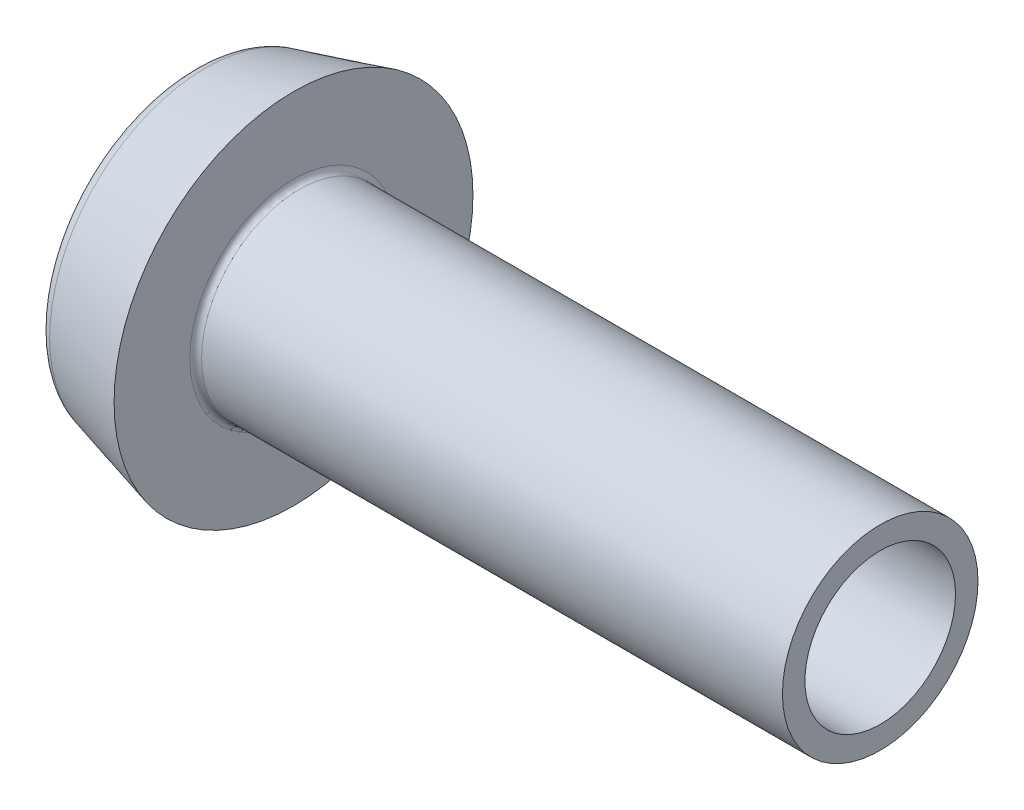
SolidWorks part; units mm, degrees
ref_plane "Front" through (0, 0, 0) normal (0, 0, 1) x (1, 0, 0)
ref_plane "Top" through (0, 0, 0) normal (0, 1, 0) x (1, 0, 0)
ref_plane "Right" through (0, 0, 0) normal (1, 0, 0) x (0, 0, -1)
other "Configuration Table"
sketch "Sketch1" plane through (0, 0, 0) normal (0, 0, 1) x (1, 0, 0)
  line L0 (-47.217, 0) -> (5.8534, 0) construction
  line L1 (35.24, 0) -> (35.24, 5)
  line L2 (35.24, 5) -> (5.54, 5)
  line L3 (5.24, 5.3) -> (5.24, 9.175)
  line L4 (5.24, 9.175) -> (0.7412, 7.9695)
  line L5 (0, 7.0036) -> (0, 0)
  line L6 (35.24, 0) -> (0, 0)
  arc A0 (5.54, 5) -> (5.24, 5.3) centre (5.54, 5.3) cw
  arc A1 (0.7412, 7.9695) -> (0, 7.0036) centre (1, 7.0036) ccw
  point P11 (5.24, 5)
  dimension "r" = 0.3
  dimension "r1" = 1
  dimension "D1" = 15
  dimension "d" = 10
  dimension "dk" = 18.35
  dimension "K" = 5.24
  dimension "l" = 30
revolve "Base-Revolve" add sketch "Sketch1" angle 360 about L0
sketch "Sketch2" plane through (0, 0, 0) normal (0, 0, 1) x (1, 0, 0)
  line L0 (1.3562, 0) -> (-19.7528, 0) construction
  line L2 (35.24, 0) -> (35.24, 3.85)
  line L4 (35.24, 3.85) -> (25.61, 3.85)
  line L5 (25.61, 3.85) -> (22.8128, 0)
  line L6 (35.24, 0) -> (22.8128, 0)
  line L7 (35.24, -5) -> (35.24, 5) construction
  dimension "dt" = 7.7
  dimension "D2" = 54
  dimension "t" = 9.63
revolve "Cut-Revolve1" cut sketch "Sketch2" angle 360 about L0
